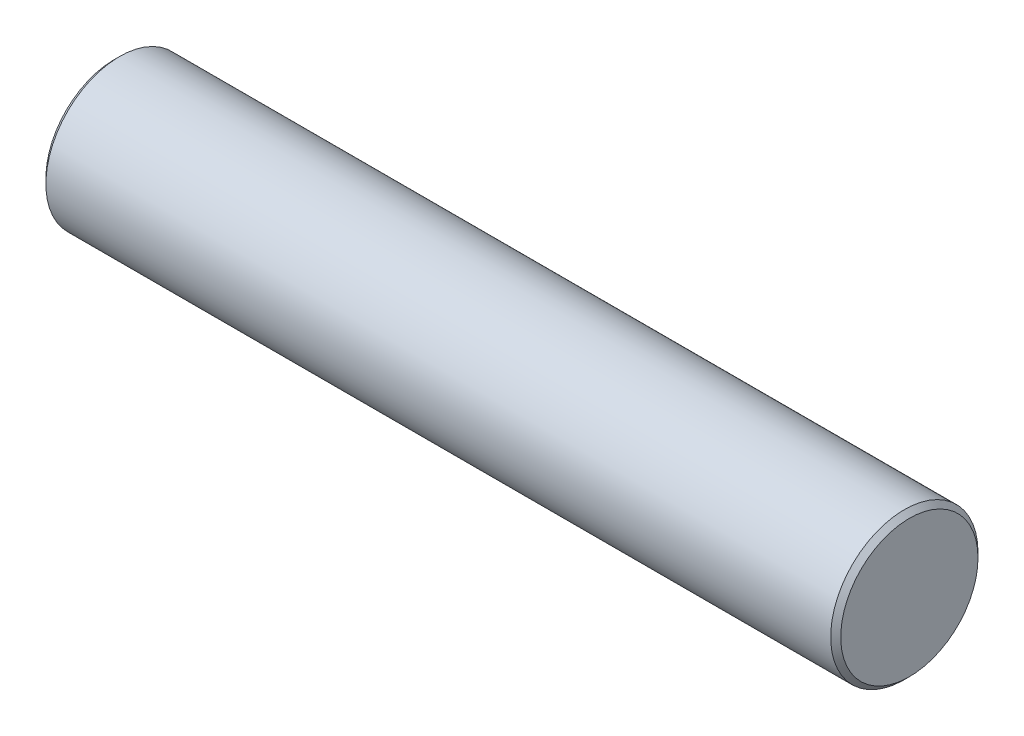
SolidWorks part; units mm, degrees
ref_plane "Front" through (0, 0, 0) normal (0, 0, 1) x (1, 0, 0)
ref_plane "Top" through (0, 0, 0) normal (0, 1, 0) x (1, 0, 0)
ref_plane "Side" through (0, 0, 0) normal (1, 0, 0) x (0, 0, -1)
sketch "Sketch1" plane through (0, 0, 0) normal (0, 0, 1) x (1, 0, 0)
  line L1 (72, 91.9464) -> (23.4405, 91.9464)
  line L2 (72, 91.9464) -> (72, 96.1395)
  line L3 (71.6931, 96.4464) -> (23.7474, 96.4464)
  line L4 (23.4405, 91.9464) -> (23.4405, 96.1395)
  line L5 (71, 96.4464) -> (69, 96.4464) construction
  line L6 (72, 94.2481) -> (72, 98.9464) construction
  line L7 (72.0327, 91.9464) -> (20.8148, 91.9464) construction
  line L8 (71, 91.9464) -> (69, 91.9464) construction
  line L10 (71.6931, 96.4464) -> (72, 96.1395)
  line L11 (71.8466, 96.293) -> (72, 96.4464) construction
  line L12 (23.4405, 96.1395) -> (23.7474, 96.4464)
  line L13 (23.5939, 96.293) -> (23.4405, 96.4464) construction
  line L14 (23.4405, 88.2251) -> (23.4405, 82.7942) construction
revolve "Base-Revolve" add sketch "Sketch1" angle 360 about L7
